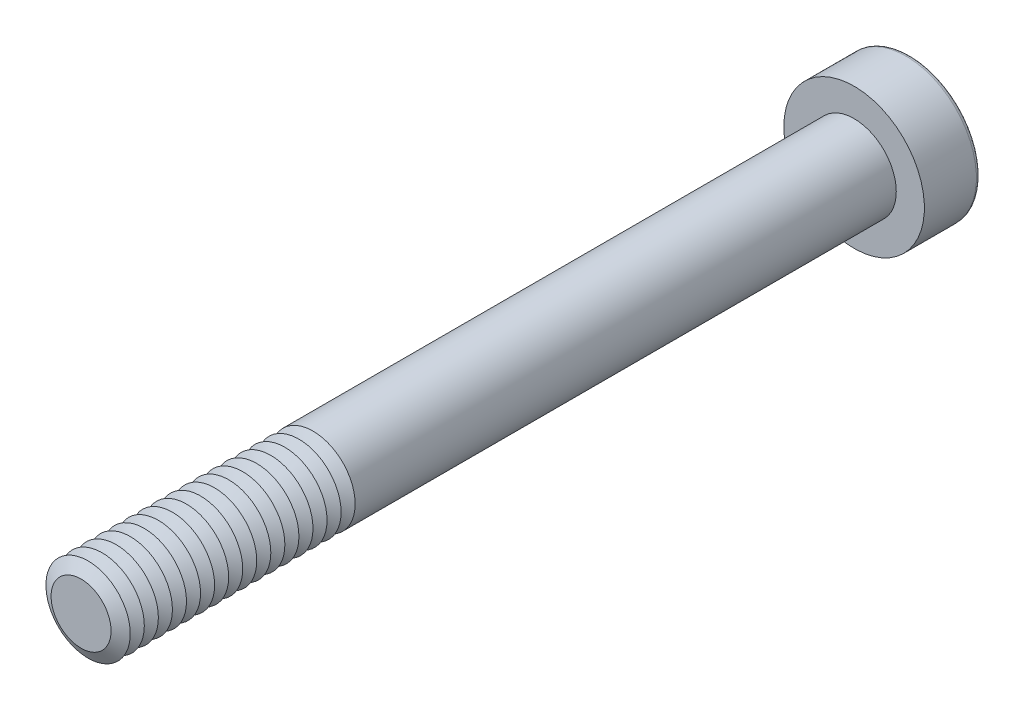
SolidWorks part; units mm, degrees
ref_plane "Front Plane" through (0, 0, 0) normal (0, 0, 1) x (1, 0, 0)
ref_plane "Top Plane" through (0, 0, 0) normal (0, 1, 0) x (1, 0, 0)
ref_plane "Right Plane" through (0, 0, 0) normal (1, 0, 0) x (0, 0, -1)
sketch "Sketch1" plane through (0, 0, 0) normal (0, 0, 1) x (1, 0, 0)
  circle A0 centre (0, 0) radius 3
  dimension "D1" = 6
extrude "Boss-Extrude1" add sketch "Sketch1" along normal blind 55
sketch "Sketch2" plane through (0, 0, 0) normal (0, 0, -1) x (-1, 0, 0)
  circle A0 centre (0, 0) radius 5
  dimension "D1" = 10
extrude "Boss-Extrude2" add sketch "Sketch2" along normal blind 4
sketch "Sketch3" plane through (0, 0, -4) normal (0, 0, -1) x (-1, 0, 0)
  line L1 (-1.1547, 2) -> (-2.3094, 0)
  line L2 (-2.3094, 0) -> (-1.1547, -2)
  line L3 (-1.1547, -2) -> (1.1547, -2)
  line L4 (1.1547, -2) -> (2.3094, 0)
  line L5 (2.3094, 0) -> (1.1547, 2)
  line L6 (1.1547, 2) -> (-1.1547, 2)
  circle A0 centre (0, 0) radius 2 construction
  dimension "D1" = 4
extrude "Cut-Extrude1" cut sketch "Sketch3" against normal blind 3
fillet "Fillet1" radius 0.3 1 edges at (-5, 0, -4)
sketch "Sketch4" plane through (0, 0, -1) normal (0, 0, -1) x (-1, 0, 0)
  line L0 (1.1547, -2) -> (2.3094, 0) construction
  circle A0 centre (0, 0) radius 2
extrude "Cut-Extrude2" cut sketch "Sketch4" against normal through all draft 60
sketch "Sketch5" plane through (0, 0, -4) normal (0, 0, -1) x (-1, 0, 0)
  circle A0 centre (0, 0) radius 2.3094
extrude "Cut-Extrude3" cut sketch "Sketch5" against normal through all draft 75
sketch "Sketch7" plane through (0, 0, 0) normal (1, 0, 0) x (0, 0, -1)
  line L25 (-55, 2.134) -> (-54.5, 3)
  line L26 (-55, 3) -> (-55, -3) construction
  line L27 (-54.5, 3) -> (-55.5, 3)
  line L28 (-55.5, 3) -> (-55, 2.134)
  line L29 (0, 3) -> (-55, 3) construction
  dimension "D1" = 1
revolve "Cut-Revolve1" cut sketch "Sketch7" angle 360 about axis through (0, 0, 55) along (0, 0, -1)
pattern_linear "LPattern1" count 17 spacing 1 along (0, 0, -1) of "Cut-Revolve1"
